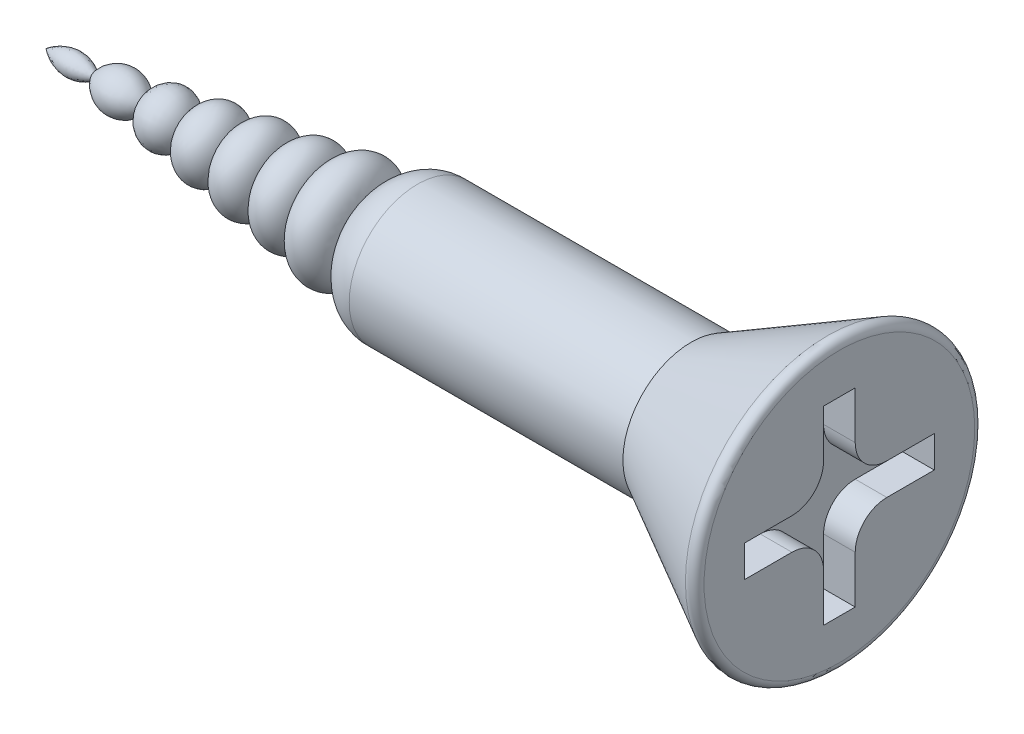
SolidWorks part; units mm, degrees
ref_plane "Front Plane" through (0, 0, 0) normal (0, 0, 1) x (1, 0, 0)
ref_plane "Top Plane" through (0, 0, 0) normal (0, 1, 0) x (1, 0, 0)
ref_plane "Right Plane" through (0, 0, 0) normal (1, 0, 0) x (0, 0, -1)
sketch "Sketch1"
sketch_block_instance "Block1-1"
sketch_block "Block1" parameters "D1"=2.3865, "D2"=12.7395, "D3"=0.7768, "D4"=0.8164, "D5"=0.7059
revolve "Revolve1" add sketch "Sketch1" angle 360 about L8
sketch "Sketch2" plane through (0, 0, 0) normal (0, 0, 1) x (1, 0, 0)
  line L0 (0, -1.7574) -> (-0.8752, -2.3813) construction
  line L1 (0, -1.7574) -> (-0.8825, -2.3865)
  line L3 (-0.8825, -2.3865) -> (0, -2.3865)
  line L4 (0, -1.7574) -> (0, -2.3865) construction
  line L5 (0, -1.7574) -> (0, -2.3865)
  line L6 (-12.7395, -2.3865) -> (0, -2.3865) construction
revolve "Cut-Revolve1" cut sketch "Sketch2" angle 360 about L3
sketch "Sketch3" plane through (0, 0, 0) normal (1, 0, 0) x (0, 0, -1)
  circle A0 centre (0, -2.3865) radius 0.629 construction
  circle A1 centre (0, -2.3865) radius 0.629
extrude "Boss-Extrude1" add sketch "Sketch3" against normal blind 0.889
sketch "Sketch4" plane through (0, 0, 0) normal (1, 0, 0) x (0, 0, -1)
  line L0 (0, 0) -> (0, -2.3865) construction
  line L1 (0, -2.3865) -> (-2.3865, -2.3865) construction
  line L2 (-0.254, -0.8625) -> (-0.254, -2.1325)
  line L3 (-0.254, -2.1325) -> (-1.524, -2.1325)
  line L4 (0.254, -2.1325) -> (1.524, -2.1325)
  line L5 (0.254, -0.8625) -> (0.254, -2.1325)
  line L6 (0.254, -2.6405) -> (1.524, -2.6405)
  line L7 (0.254, -3.9105) -> (0.254, -2.6405)
  line L8 (-0.254, -3.9105) -> (-0.254, -2.6405)
  line L9 (-0.254, -2.6405) -> (-1.524, -2.6405)
  line L10 (0.254, -0.8625) -> (-0.254, -0.8625)
  line L11 (-1.524, -2.1325) -> (-1.524, -2.6405)
  line L12 (-0.254, -3.9105) -> (0.254, -3.9105)
  line L13 (1.524, -2.1325) -> (1.524, -2.6405)
  circle A0 centre (0, -2.3865) radius 2.3865 construction
  dimension "D1" = 1.524
  dimension "D2" = 1.524
  dimension "D3" = 0.254
  dimension "D4" = 0.254
extrude "Cut-Extrude1" cut sketch "Sketch4" against normal blind 0.508
fillet "Fillet1" radius 0.508 4 edges at (-0.254, -2.6405, 0.254) (-0.254, -2.6405, -0.254) (-0.254, -2.1325, -0.254) (-0.254, -2.1325, 0.254)
fillet "Fillet2" radius 0.127 1 edges at (0, -2.3865, 2.3865)
